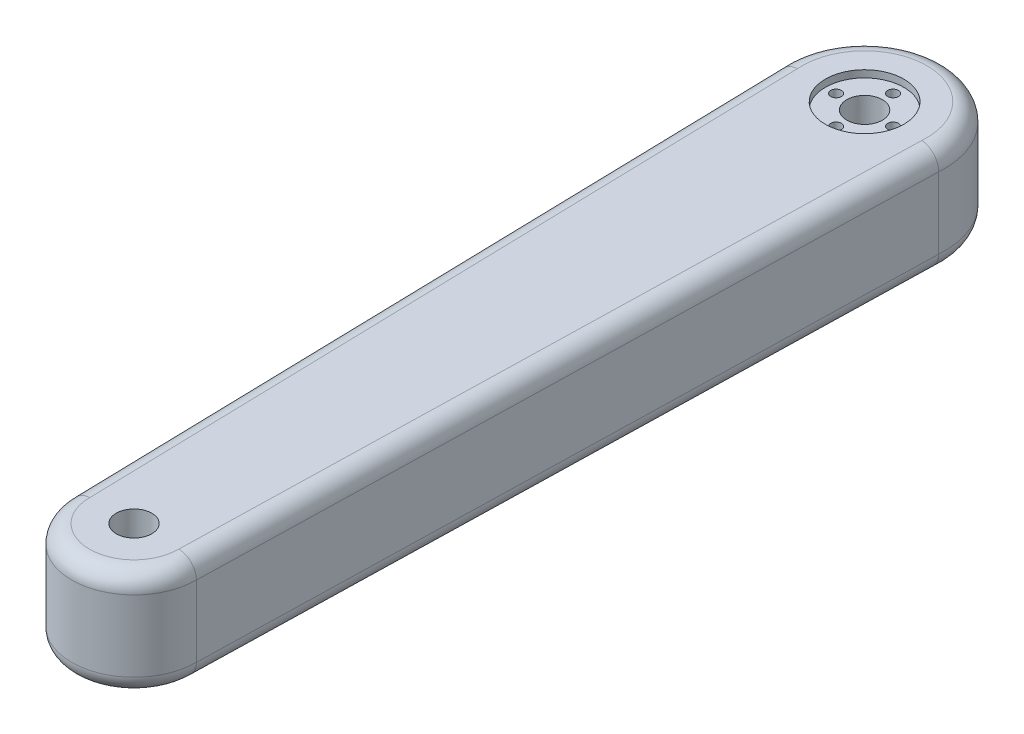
SolidWorks part; units mm, degrees
ref_plane "Front Plane" through (0, 0, 0) normal (0, 0, 1) x (1, 0, 0)
ref_plane "Top Plane" through (0, 0, 0) normal (0, 1, 0) x (1, 0, 0)
ref_plane "Right Plane" through (0, 0, 0) normal (1, 0, 0) x (0, 0, -1)
sketch "Sketch1" plane through (0, 0, 0) normal (0, 1, 0) x (1, 0, 0)
  line L0 (0, 0) -> (0, -205) construction
  line L1 (-17.5, -205) -> (-22.4398, -1.6441)
  line L2 (17.5, -205) -> (22.4398, -1.6441)
  arc A0 (22.4398, -1.6441) -> (-22.4398, -1.6441) centre (0, 0) ccw
  arc A1 (-17.5, -205) -> (17.5, -205) centre (0, -205) ccw
  dimension "D1" = 45
  dimension "D2" = 35
  dimension "D3" = 205
  dimension "D4" = 203.3559
extrude "Boss-Extrude1" add sketch "Sketch1" along normal blind 30
fillet "Fillet2" radius 5 4 edges at (19.9699, 30, 103.3221) (0, 30, 222.5) (-19.9699, 30, 103.3221) (0, 30, -22.5)
fillet "Fillet3" radius 5 4 edges at (-19.9699, 0, 103.3221) (0, 0, 222.5) (19.9699, 0, 103.3221) (0, 0, -22.5)
sketch "Sketch2" plane through (0, 30, 0) normal (0, 1, 0) x (1, 0, 0)
  circle A0 centre (0, 0) radius 11
  dimension "D1" = 22
extrude "Cut-Extrude1" cut sketch "Sketch2" against normal blind 2
sketch "Sketch3" plane through (0, 0, 0) normal (0, -1, 0) x (1, 0, 0)
  circle A0 centre (0, 0) radius 11
  dimension "D1" = 22
extrude "Cut-Extrude2" cut sketch "Sketch3" against normal blind 3
sketch "Sketch4" plane through (0, 28, 0) normal (0, 1, 0) x (1, 0, 0)
  circle A0 centre (0, 0) radius 5
  dimension "D1" = 10
extrude "Cut-Extrude3" cut sketch "Sketch4" against normal through all
sketch "Sketch5" plane through (0, 28, 0) normal (0, 1, 0) x (1, 0, 0)
  line L0 (0, 5) -> (0, 9.5) construction
  line L1 (-5, 0) -> (-6.5, 0) construction
  line L2 (-9.5, 0) -> (-11, 0) construction
  line L3 (0, -9.5) -> (0, -5) construction
  line L4 (0, 9.5) -> (0, 11) construction
  line L5 (6.5, 0) -> (5, 0) construction
  line L6 (9.5, 0) -> (11, 0) construction
  line L7 (0, -9.5) -> (0, -11) construction
  circle A0 centre (0, 0) radius 11 construction
  circle A1 centre (0, 0) radius 11 construction
  circle A2 centre (0, 0) radius 5 construction
  circle A3 centre (0, 8) radius 1.5
  circle A4 centre (-8, 0) radius 1.5
  circle A5 centre (8, 0) radius 1.5
  circle A6 centre (0, -8) radius 1.5
  dimension "D2" = 3
  dimension "D1" = 8
extrude "Cut-Extrude4" cut sketch "Sketch5" against normal blind 8
sketch "Sketch6" plane through (0, 3, 0) normal (0, -1, 0) x (1, 0, 0)
  line L0 (0, 5) -> (0, 8.5) construction
  line L1 (0, 8.5) -> (0, 11) construction
  line L2 (6.5, 0) -> (5, 0) construction
  line L3 (8.5, 0) -> (11, 0) construction
  line L4 (0, -8.5) -> (0, -11) construction
  line L5 (0, -8.5) -> (0, -5) construction
  line L6 (-5, 0) -> (-6.5, 0) construction
  line L7 (-8.5, 0) -> (-11, 0) construction
  circle A3 centre (0, 7.5) radius 1
  circle A4 centre (7.5, 0) radius 1
  circle A5 centre (0, -7.5) radius 1
  circle A6 centre (-7.5, 0) radius 1
  circle A7 centre (0, 0) radius 5 construction
  circle A8 centre (0, 0) radius 11 construction
  circle A9 centre (0, 0) radius 11 construction
  dimension "D1" = 2
  dimension "D2" = 2.5
extrude "Cut-Extrude5" cut sketch "Sketch6" against normal blind 8
sketch "Sketch7" plane through (0, 30, 0) normal (0, 1, 0) x (1, 0, 0)
sketch "Sketch8" plane through (0, 30, 0) normal (0, 1, 0) x (1, 0, 0)
  circle A0 centre (0, -205) radius 10.5
  dimension "D1" = 21
extrude "Cut-Extrude6" cut sketch "Sketch8" against normal blind 2
sketch "Sketch9" plane through (0, 28, 0) normal (0, 1, 0) x (1, 0, 0)
  circle A0 centre (0, -205) radius 5
  dimension "D1" = 10
extrude "Cut-Extrude7" cut sketch "Sketch9" against normal through all
sketch "Sketch10" plane through (0, 28, 0) normal (0, 1, 0) x (1, 0, 0)
  line L0 (-8, -205) -> (-10.5, -205) construction
  line L1 (-6, -205) -> (-5, -205) construction
  line L2 (0, -211) -> (0, -210) construction
  line L3 (0, -213) -> (0, -215.5) construction
  line L4 (5, -205) -> (6, -205) construction
  line L5 (8, -205) -> (10.5, -205) construction
  line L6 (0, -199) -> (0, -200) construction
  line L7 (0, -197) -> (0, -194.5) construction
  circle A3 centre (0, -198) radius 1
  circle A4 centre (7, -205) radius 1
  circle A5 centre (0, -212) radius 1
  circle A6 centre (-7, -205) radius 1
  circle A7 centre (0, -205) radius 10.5 construction
  circle A8 centre (0, -205) radius 5 construction
  circle A9 centre (0, -205) radius 10.5 construction
  dimension "D1" = 2
  dimension "D2" = 2.5
extrude "Cut-Extrude8" cut sketch "Sketch10" against normal blind 8
sketch "Croquis3" plane through (0, 0, 0) normal (0, -1, 0) x (1, 0, 0)
  circle A0 centre (0, 0) radius 11
  circle A1 centre (0, 0) radius 6.375
  dimension "D1" = 22
  dimension "D2" = 12.75
extrude "Saliente-Extruir2" add sketch "Croquis3" against normal blind 5
sketch "Croquis4" plane through (0, 30, 0) normal (0, 1, 0) x (1, 0, 0)
  circle A1 centre (0, -205) radius 5
  circle A2 centre (0, -205) radius 10.5
extrude "Saliente-Extruir3" add sketch "Croquis4" against normal blind 5
sketch "Croquis5" plane through (0, 0, 0) normal (0, -1, 0) x (1, 0, 0)
  circle A0 centre (0, 0) radius 6.5
  dimension "D1" = 13
extrude "Cortar-Extruir1" cut sketch "Croquis5" against normal up to surface (3 mm away)
